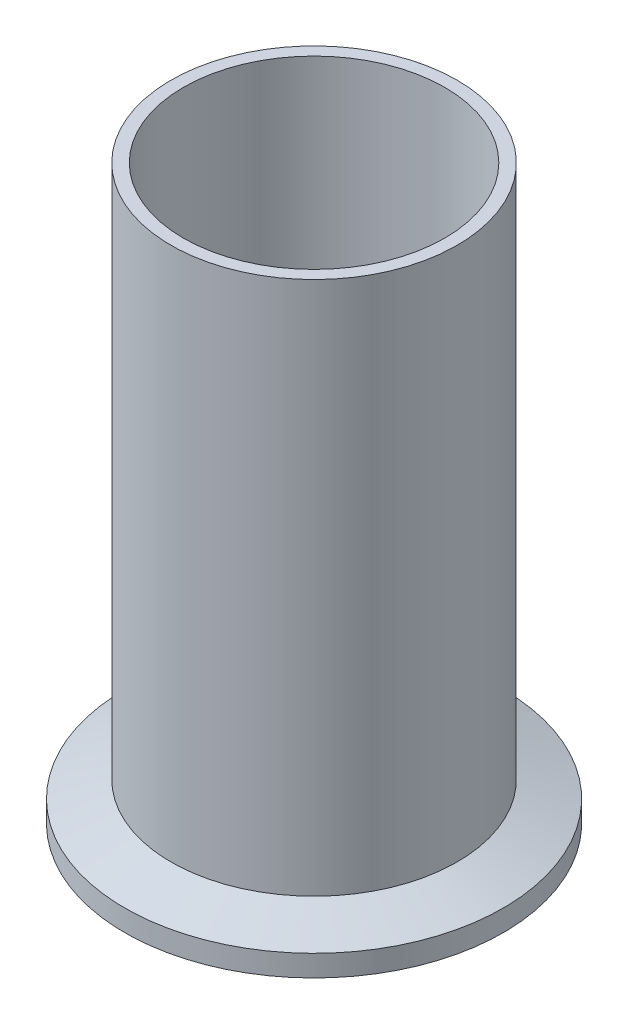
SolidWorks part; units mm, degrees
ref_plane "Front Plane" through (0, 0, 0) normal (0, 0, 1) x (1, 0, 0)
ref_plane "Top Plane" through (0, 0, 0) normal (0, 1, 0) x (1, 0, 0)
ref_plane "Right Plane" through (0, 0, 0) normal (1, 0, 0) x (0, 0, -1)
sketch "Sketch1" plane through (0, 0, 0) normal (0, 0, 1) x (1, 0, 0)
  line L0 (0, 0) -> (0, 76.2) construction
  line L1 (0, 76.2) -> (-19.05, 76.2)
  line L2 (-19.05, 76.2) -> (-19.05, 5.0821)
  line L3 (-19.05, 5.0821) -> (-25.1968, 2.8448)
  line L4 (-25.1968, 2.8448) -> (-25.1968, 0)
  line L5 (-25.1968, 0) -> (-23.6366, 0)
  line L6 (-20.0006, 0) -> (0, 0)
  line L7 (0, 0) -> (0, 76.2)
  line L8 (0, 76.2) -> (-17.399, 76.2)
  line L9 (-17.399, 76.2) -> (-17.399, 0)
  line L10 (-17.399, 0) -> (0, 0)
  line L11 (0, 0) -> (-0.1846, 0.0129)
  arc A0 (-22.9141, 0.4745) -> (-20.7231, 0.4745) centre (-21.8186, 0) cw
  arc A1 (-20.0006, 0) -> (-20.7231, 0.4745) centre (-20.0006, 0.7874) cw
  arc A2 (-22.9141, 0.4745) -> (-23.6366, 0) centre (-23.6366, 0.7874) cw
  point P12 (-20.6248, 0)
  dimension "D6" = 1.1938
  dimension "D7" = 0.7874
  dimension "D1" = 19.05
  dimension "D2" = 2.8448
  dimension "D3" = 25.1968
  dimension "D4" = 70
  dimension "D5" = 21.8186
  dimension "D8" = 1.651
  dimension "D9" = 76.2
revolve "Revolve2" add sketch "Sketch1" angle 360 about L0
